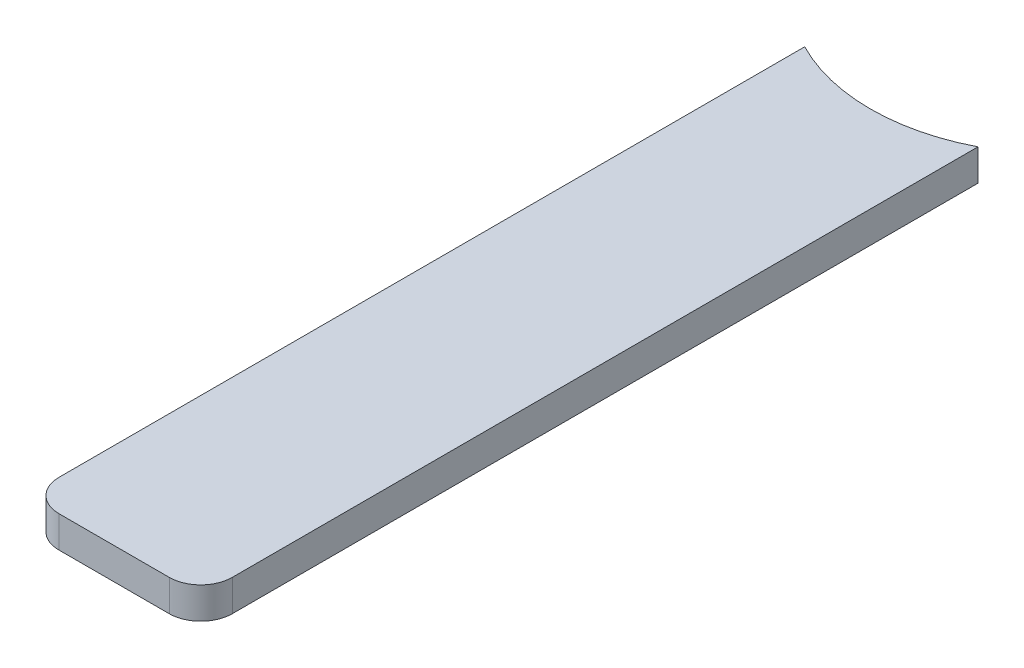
SolidWorks part; units mm, degrees
ref_plane "Front Plane" through (0, 0, 0) normal (0, 0, 1) x (1, 0, 0)
ref_plane "Top Plane" through (0, 0, 0) normal (0, 1, 0) x (1, 0, 0)
ref_plane "Right Plane" through (0, 0, 0) normal (1, 0, 0) x (0, 0, -1)
sketch "Sketch1" plane through (0, 0, 0) normal (0, 0, 1) x (1, 0, 0)
  line L0 (0, -361.2964) -> (0, 612.4697) construction
  line L1 (-27.5, -826.4028) -> (27.5, -826.4028)
  line L2 (-27.5, -826.4028) -> (-27.5, -836.4028)
  line L3 (-27.5, -836.4028) -> (27.5, -836.4028)
  line L4 (27.5, -826.4028) -> (27.5, -836.4028)
  line L5 (-27.5, -826.4028) -> (27.5, -836.4028) construction
  line L6 (-27.5, -836.4028) -> (27.5, -826.4028) construction
  line L7 (300, -866.4028) -> (-300, -866.4028) construction
  point P0 (0, -831.4028)
  dimension "D1" = 55
  dimension "D2" = 10
  dimension "D3" = 30
extrude "Boss-Extrude1" add sketch "Sketch1" against normal up to surface (246.6732 mm away)
fillet "Fillet1" radius 10 2 edges at (27.5, -831.4028, 0) (-27.5, -831.4028, 0)
